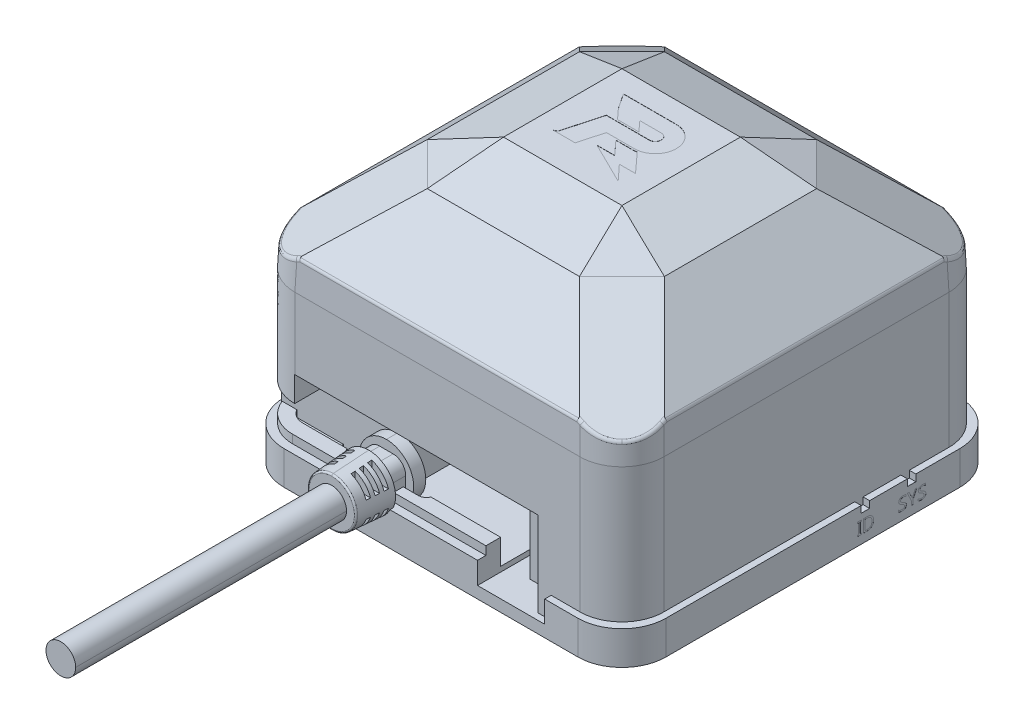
SolidWorks part; units mm, degrees
other "1"
other "3"
other "2" parameters "D3"=10, "D4"=5, "D5"=5, "D6"=5, "D7"=5
ref_plane "前视基准面" through (0, 0, 0) normal (0, 0, 1) x (1, 0, 0)
ref_plane "上视基准面" through (0, 0, 0) normal (0, 1, 0) x (1, 0, 0)
ref_plane "右视基准面" through (0, 0, 0) normal (1, 0, 0) x (0, 0, -1)
other "Configuration Table"
imported_body "RoboMaster 定位模块 UW01 2020.STEP<1>"
sketch "草图2" plane through (0, -32.7493, 0) normal (0, -1, 0) x (1, 0, 0)
  line L1 (32.7616, 75.4597) -> (148.0664, 75.4597)
  line L2 (32.7616, 75.4597) -> (32.7616, -47.8184)
  line L3 (32.7616, -47.8184) -> (148.0664, -47.8184)
  line L4 (148.0664, 75.4597) -> (148.0664, -47.8184)
extrude "切除-拉伸1" cut sketch "草图2" against normal blind 20
sketch "草图15" plane through (0, -1.7493, 0) normal (0, -1, 0) x (1, 0, 0)
  line L0 (67.0186, 7.7645) -> (72.0186, 12.7645)
  line L5 (87.5475, 12.7645) -> (92.5475, 7.7645)
  line L6 (87.5475, -12.7645) -> (92.5475, -7.7645)
  line L7 (67.0186, -7.7645) -> (72.0186, -12.7645)
  line L9 (71.2288, -12.7645) -> (88.3373, -12.7645) construction
  line L10 (72.0186, 12.7645) -> (87.5475, 12.7645)
  line L11 (67.0186, 7.7645) -> (67.0186, -7.7645)
  line L12 (72.0186, -12.7645) -> (87.5475, -12.7645)
  line L13 (92.5475, 7.7645) -> (92.5475, -7.7645)
  line L14 (67.0186, 8.5543) -> (67.0186, -8.5543) construction
  line L15 (92.5475, -8.5543) -> (92.5475, 8.5543) construction
  line L16 (88.3373, 12.7645) -> (71.2288, 12.7645) construction
  point P0 (67.0186, 12.7645)
  point P1 (92.5475, -12.7645)
  point P2 (67.0186, -12.7645)
  point P3 (92.5475, 12.7645)
extrude "凸台-拉伸7" add sketch "草图15" along normal up to vertex
sketch "草图4" plane through (0, -12.7493, 0) normal (0, -1, 0) x (1, 0, 0)
  line L0 (62.8038, 21.9762) -> (96.7623, 21.9762) construction
  line L1 (101.7592, 16.9792) -> (101.7592, -16.9792) construction
  line L2 (96.7623, -21.9762) -> (62.8038, -21.9762) construction
  line L3 (57.8069, -16.9792) -> (57.8069, 16.9792) construction
  line L4 (62.8038, 21.9762) -> (96.7623, 21.9762)
  line L5 (101.7592, 16.9792) -> (101.7592, -16.9792)
  line L6 (96.7623, -21.9762) -> (62.8038, -21.9762)
  line L7 (57.8069, -16.9792) -> (57.8069, 16.9792)
  ellipse E0 centre (96.7562, 16.9731) end of major axis (100.296, 20.513) minor radius 5 (101.7592, 16.9792) -> (96.7623, 21.9762) ccw construction
  ellipse E1 centre (96.7562, -16.9731) end of major axis (100.296, -20.513) minor radius 5 (96.7623, -21.9762) -> (101.7592, -16.9792) ccw construction
  ellipse E2 centre (62.8099, -16.9731) end of major axis (59.2701, -20.513) minor radius 5 (57.8069, -16.9792) -> (62.8038, -21.9762) ccw construction
  ellipse E3 centre (62.8099, 16.9731) end of major axis (59.2701, 20.513) minor radius 5 (62.8038, 21.9762) -> (57.8069, 16.9792) ccw construction
  ellipse E4 centre (96.7562, 16.9731) end of major axis (100.296, 20.513) minor radius 5 (101.7592, 16.9792) -> (96.7623, 21.9762) ccw
  ellipse E5 centre (96.7562, -16.9731) end of major axis (100.296, -20.513) minor radius 5 (96.7623, -21.9762) -> (101.7592, -16.9792) ccw
  ellipse E6 centre (62.8099, -16.9731) end of major axis (59.2701, -20.513) minor radius 5 (57.8069, -16.9792) -> (62.8038, -21.9762) ccw
  ellipse E7 centre (62.8099, 16.9731) end of major axis (66.3498, 13.4333) minor radius 5 (62.8038, 21.9762) -> (57.8069, 16.9792) ccw
extrude "凸台-拉伸1" add sketch "草图4" along normal blind 20
sketch "草图5" plane through (0, -32.7493, 0) normal (0, -1, 0) x (1, 0, 0)
  line L0 (96.7623, 21.9762) -> (62.8038, 21.9762) construction
  line L1 (62.783, 21.9762) -> (91.783, 21.9762)
  line L2 (62.783, 21.9762) -> (62.783, 18.9762)
  line L3 (62.783, 18.9762) -> (91.783, 18.9762)
  line L4 (91.783, 21.9762) -> (91.783, 18.9762)
  line L5 (62.8038, -21.9762) -> (96.7623, -21.9762) construction
  line L6 (71.783, 18.9762) -> (87.783, 18.9762)
  line L7 (71.783, 18.9762) -> (71.783, -17.9762)
  line L8 (71.783, -17.9762) -> (87.783, -17.9762)
  line L9 (87.783, 18.9762) -> (87.783, -17.9762)
  point P6 (79.783, 21.9762)
  dimension "D1" = 29
  dimension "D2" = 3
  dimension "D3" = 12
  dimension "D4" = 4
  dimension "D5" = 16
  dimension "D6" = 4
extrude "切除-拉伸2" cut sketch "草图5" against normal blind 11.5 contours L4 L2 L3 M16 M9 | L9 L3 L7 L8
sketch "草图6" plane through (0, 0, 18.9762) normal (0, 0, 1) x (1, 0, 0)
  line L0 (62.783, -21.2493) -> (62.783, -32.7493) construction
  line L1 (62.783, -29.7493) -> (57.8069, -29.7493)
  line L2 (62.783, -29.7493) -> (62.783, -24.2493)
  line L3 (62.783, -24.2493) -> (57.8069, -24.2493)
  line L4 (57.8069, -29.7493) -> (57.8069, -24.2493)
  line L5 (57.8069, -32.7493) -> (57.8069, -12.7493) construction
  line L6 (57.8069, -32.7493) -> (62.783, -32.7493) construction
  line L7 (91.783, -21.2493) -> (62.8038, -21.2493) construction
  dimension "D1" = 3
  dimension "D2" = 3
extrude "切除-拉伸3" cut sketch "草图6" along normal through all
sketch "草图7" plane through (0, -32.7493, 0) normal (0, -1, 0) x (1, 0, 0)
  line L0 (62.8038, -21.9762) -> (96.7623, -21.9762) construction
  line L1 (101.7592, -16.9792) -> (101.7592, 16.9792) construction
  circle A0 centre (62.783, -17) radius 1.45
  circle A1 centre (96.783, -17) radius 1.45
  circle A2 centre (96.783, 17) radius 1.45
  circle A3 centre (62.783, 17) radius 1.45
  point P13 (79.783, -21.9762)
  point P16 (101.7592, 0)
  dimension "D1" = 2.9
  dimension "D2" = 34
  dimension "D3" = 34
  dimension "D4" = 17
  dimension "D5" = 17
extrude "切除-拉伸4" cut sketch "草图7" against normal blind 10
